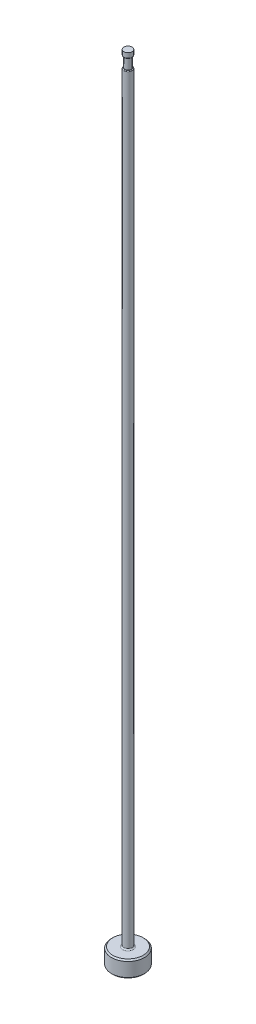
SolidWorks part; units mm, degrees
ref_plane "Front Plane" through (0, 0, 0) normal (0, 0, 1) x (1, 0, 0)
ref_plane "Top Plane" through (0, 0, 0) normal (0, 1, 0) x (1, 0, 0)
ref_plane "Right Plane" through (0, 0, 0) normal (1, 0, 0) x (0, 0, -1)
other "Configuration Table"
sketch "Sketch1" plane through (0, 0, 0) normal (0, 0, 1) x (1, 0, 0)
  line L0 (0, 259.9588) -> (0, -15.1925) construction
  line L1 (0, 0) -> (-3.175, 0)
  line L2 (-3.175, 0) -> (-3.175, 3.175)
  line L3 (-3.175, 3.175) -> (-0.7937, 3.175)
  line L4 (-0.7937, 3.175) -> (-0.7937, 152.4)
  line L5 (-0.7937, 152.4) -> (0, 152.4)
  line L6 (0, 152.4) -> (0, 0)
  dimension "L" = 152.4
  dimension "H" = 6.35
  dimension "T" = 3.175
  dimension "D" = 1.5875
revolve "Revolve1" add sketch "Sketch1" angle 360 about L0
chamfer "Chamfer1" distance 0.254 angle 45 2 edges at (0, 3.175, 3.175) (0, 0, 3.175)
fillet "Fillet1" radius 0.254 1 edges at (0, 3.175, 0.7937)
sketch "Sketch2" plane through (0, 0, 0) normal (0, 0, 1) x (1, 0, 0)
  line L0 (-0.7937, 152.4) -> (-0.7937, 3.429) construction
  line L1 (-0.7937, 151.384) -> (-0.5905, 151.384)
  line L2 (-0.7937, 151.384) -> (-0.7937, 149.352)
  line L3 (-0.7937, 149.352) -> (-0.5905, 149.352)
  line L4 (-0.5905, 151.384) -> (-0.5905, 149.352)
  line L5 (0.7937, 152.4) -> (-0.7937, 152.4) construction
  line L6 (0, 153.4483) -> (0, 147.3282) construction
  dimension "D1" = 2.032
  dimension "N" = 1.016
  dimension "FD" = 0.2032
  dimension "D3" = 1.1811
revolve "Vent Relief" cut sketch "Sketch2" angle 360 about L6
sketch "Sketch3" plane through (0, 0, 0) normal (0, 0, 1) x (1, 0, 0)
  line L0 (-0.5905, 150.368) -> (-0.5905, 86.868)
  line L1 (-0.5905, 151.384) -> (-0.5905, 149.352) construction
  line L2 (-0.7937, 149.352) -> (-0.7937, 3.429) construction
  line L3 (-0.7937, 85.7504) -> (-0.7937, 150.368)
  line L4 (-0.7937, 150.368) -> (-0.5905, 150.368)
  arc A0 (-0.5905, 86.868) -> (-0.7937, 85.7504) centre (-3.7655, 86.868) cw
  dimension "D1" = 3.175
  dimension "D2" = 63.5
extrude "D-Slot" cut sketch "Sketch3" against normal through all both and the other way through all
sketch "Sketch5" plane through (0, 0, 0) normal (0, 0, 1) x (1, 0, 0)
  line L0 (-0.7937, 151.384) -> (0.7937, 151.384) construction
  line L1 (-0.7937, 152.4) -> (-0.7887, 152.4)
  line L2 (-0.7937, 152.4) -> (-0.7937, 151.384)
  line L3 (-0.7937, 151.384) -> (-0.7887, 151.384)
  line L4 (-0.7887, 152.4) -> (-0.7887, 151.384)
  line L5 (0, 152.6877) -> (0, 150.5771) construction
  dimension "VP" = 0.0051
revolve "Vent Diameter" cut sketch "Sketch5" angle 360 about L5
fillet "Fillet2" radius 0.127 2 edges at (0.7937, 149.352, 0) (0, 151.384, 0.7887)
sketch "Pocket Sketch" plane through (0, 0, 0) normal (0, 0, 1) x (1, 0, 0)
  line L0 (-3.5719, 0) -> (-3.5719, 3.2004)
  line L1 (-3.5719, 3.2004) -> (-1.7542, 3.2004)
  line L2 (-0.9922, 3.9624) -> (-0.9922, 22.225)
  line L3 (-0.9922, 22.225) -> (0, 22.225)
  line L4 (0, 22.225) -> (0, 0)
  line L5 (0, 0) -> (-3.5719, 0)
  line L6 (0, 12.6104) -> (0, -2.4989) construction
  line L7 (-3.175, 2.921) -> (-3.175, 0.254) construction
  line L8 (2.921, 3.175) -> (-2.921, 3.175) construction
  line L9 (-0.7937, 85.7504) -> (-0.7937, 3.429) construction
  line L10 (-1.7542, 3.2004) -> (-0.9922, 3.9624)
  point P3 (-0.9922, 3.2004)
  dimension "D1" = 7.1437
  dimension "D2" = 0.3969
  dimension "D3" = 0.0254
  dimension "D4" = 0.1984
  dimension "D5" = 1.9844
  dimension "D6" = 22.225
